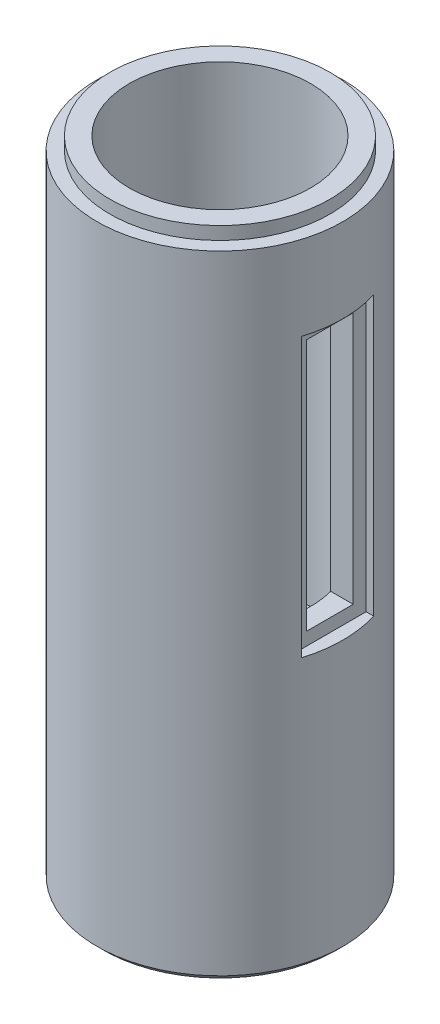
SolidWorks part; units mm, degrees
ref_plane "Front Plane" through (0, 0, 0) normal (0, 0, 1) x (1, 0, 0)
ref_plane "Top Plane" through (0, 0, 0) normal (0, 1, 0) x (1, 0, 0)
ref_plane "Right Plane" through (0, 0, 0) normal (1, 0, 0) x (0, 0, -1)
sketch "Sketch1" plane through (0, 0, 0) normal (0, 0, 1) x (1, 0, 0)
  line L0 (0, 0) -> (-13, 0) construction
  line L1 (-13, 0) -> (-13, 20)
  line L2 (-13, 20) -> (-14, 20)
  line L3 (-14, 20) -> (-14, 0)
  line L4 (-14, 0) -> (-19, 0)
  line L5 (-19, 0) -> (-19, 100)
  line L6 (-19, 100) -> (0, 100)
  line L7 (0, 190.0734) -> (0, -52.5194) construction
  line L8 (0, 0) -> (0, 100)
  line L9 (-13, 0) -> (-10, 0)
  line L10 (-10, 0) -> (-10, 30)
  line L11 (-10, 30) -> (-14, 30)
  line L12 (-14, 30) -> (-14, 100)
  line L13 (-14, 100) -> (0, 100)
  point P4 (0, 0)
  point P12 (-14, 121.5765)
  point P18 (0, 0)
  dimension "D1" = 5
  dimension "D2" = 1
  dimension "D3" = 20
  dimension "D4" = 13
  dimension "D5" = 100
  dimension "D6" = 3
  dimension "D7" = 30
revolve "Revolve2" add sketch "Sketch1" angle 360 about L8
chamfer "Chamfer2" distance 1 angle 45 1 edges at (0, 0, -19)
ref_plane "Plane1" through (-19, 0, 0) normal (-1, 0, 0) x (0, 0, 1)
sketch "Sketch2" plane through (-19, 0, 0) normal (-1, 0, 0) x (0, 0, 1)
  line L0 (0, 0) -> (0, 50) construction
  circle A0 centre (0, 50) radius 10
  dimension "D2" = 20
  dimension "D1" = 50
extrude "Cut-Extrude1" cut sketch "Sketch2" against normal up to next contours A0
ref_plane "Plane2" through (19, 0, 0) normal (1, 0, 0) x (0, 0, -1)
sketch "Sketch3" plane through (19, 0, 0) normal (1, 0, 0) x (0, 0, -1)
  line L0 (0, 46) -> (0, 50) construction
  line L1 (-1.5875, 46) -> (1.5875, 46)
  line L6 (-3.5875, 83) -> (3.5875, 83)
  line L7 (-3.5875, 83) -> (-3.5875, 44)
  line L8 (-3.5875, 44) -> (3.5875, 44)
  line L9 (3.5875, 83) -> (3.5875, 44)
  point P0 (0, 50)
  point P3 (0, 0)
  point P12 (0, 44)
  dimension "D1" = 3.175
  dimension "D3" = 4
  dimension "D4" = 7.175
  dimension "D5" = 39
  dimension "D6" = 6
extrude "Cut-Extrude3" cut sketch "Sketch3" against normal up to next contours L7 L8 L9 L6
sketch "Sketch4" plane through (19, 0, 0) normal (1, 0, 0) x (0, 0, -1)
  line L0 (-5.5875, 85) -> (-3.5875, 83) construction
  line L1 (-5.5875, 85) -> (5.5875, 85)
  line L2 (-5.5875, 85) -> (-5.5875, 42)
  line L3 (-5.5875, 42) -> (5.5875, 42)
  line L4 (5.5875, 85) -> (5.5875, 42)
  line L5 (3.5875, 44) -> (5.5875, 42) construction
  point P7 (0, 0)
  dimension "D1" = 11.175
  dimension "D2" = 43
extrude "Cut-Extrude4" cut sketch "Sketch4" against normal blind 2 contours L2 L3 L4 L1
sketch "Sketch5" plane through (0, 0, 0) normal (0, 0, 1) x (1, 0, 0)
  line L1 (-19, 100) -> (-17, 100)
  line L2 (-19, 100) -> (-19, 98)
  line L3 (-19, 98) -> (-17, 98)
  line L4 (-17, 100) -> (-17, 98)
  dimension "D1" = 2
  dimension "D2" = 2
revolve "Cut-Revolve1" cut sketch "Sketch5" angle 360 about axis through (0, 0, 0) along (0, -1, 0)
